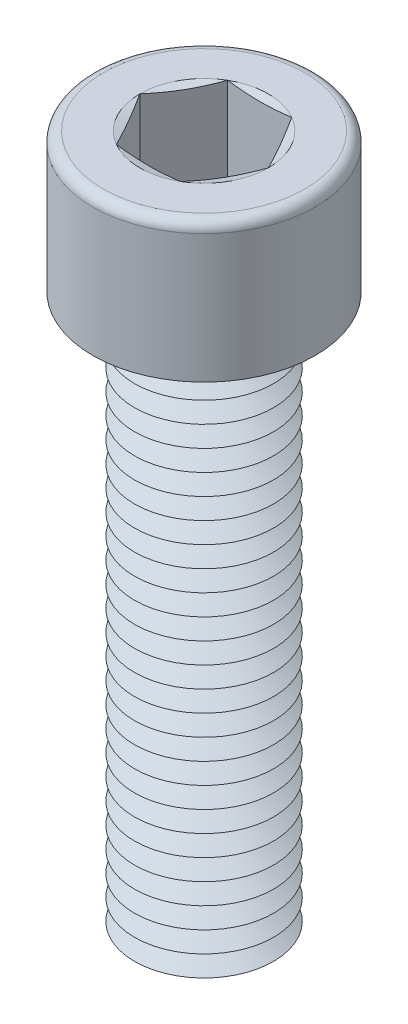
SolidWorks part; units mm, degrees
ref_plane "Front Plane" through (0, 0, 0) normal (0, 0, 1) x (1, 0, 0)
ref_plane "Top Plane" through (0, 0, 0) normal (0, 1, 0) x (1, 0, 0)
ref_plane "Right Plane" through (0, 0, 0) normal (1, 0, 0) x (0, 0, -1)
sketch "Sketch1" plane through (0, 0, 0) normal (0, 1, 0) x (1, 0, 0)
  circle A0 centre (0, 0) radius 5
  dimension "D1" = 10
extrude "Extrude1" add sketch "Sketch1" along normal blind 40
sketch "Sketch2" plane through (0, 40, 0) normal (0, 1, 0) x (1, 0, 0)
  circle A0 centre (0, 0) radius 8
  dimension "D1" = 16
extrude "Extrude2" add sketch "Sketch2" along normal blind 10
sketch "Sketch3" plane through (0, 50, 0) normal (0, 1, 0) x (1, 0, 0)
  line L1 (2.3094, 4) -> (-2.3094, 4)
  line L2 (-2.3094, 4) -> (-4.6188, 0)
  line L3 (-4.6188, 0) -> (-2.3094, -4)
  line L4 (-2.3094, -4) -> (2.3094, -4)
  line L5 (2.3094, -4) -> (4.6188, 0)
  line L6 (4.6188, 0) -> (2.3094, 4)
  circle A0 centre (0, 0) radius 4 construction
  dimension "D1" = 8
extrude "Extrude3" cut sketch "Sketch3" against normal blind 8
fillet "Fillet1" radius 0.75 1 edges at (0, 50, 8)
sketch "Sketch4" plane through (0, 0, 0) normal (1, 0, 0) x (0, 0, -1)
  line L0 (-4, 42) -> (0, 42)
  line L1 (0, 42) -> (0, 39.6906)
  line L2 (0, 39.6906) -> (-4, 42)
  dimension "D1" = 30
revolve "Cut-Revolve1" cut sketch "Sketch4" angle 360 about L1
sketch "Sketch5" plane through (0, 0, 0) normal (0, 0, 1) x (1, 0, 0)
  line L0 (-5, 0.75) -> (-5, -0.75)
  line L1 (-5, 40) -> (-5, 0) construction
  line L2 (-5, -0.75) -> (-3.701, 0)
  line L3 (-5, 0) -> (5, 0) construction
  line L4 (-3.701, 0) -> (-5, 0.75)
  dimension "D1" = 1.5
revolve "Cut-Revolve2" cut sketch "Sketch5" angle 360 about axis through (0, 40, 0) along (0, -1, 0)
pattern_linear "LPattern1" count 27 spacing 1.5 along (0, 1, 0) of "Cut-Revolve2"
sketch "Sketch6" plane through (0, 50, 0) normal (0, 1, 0) x (1, 0, 0)
  circle A0 centre (0, 0) radius 4.6188
extrude "Extrude4" cut sketch "Sketch6" against normal through all draft 75
